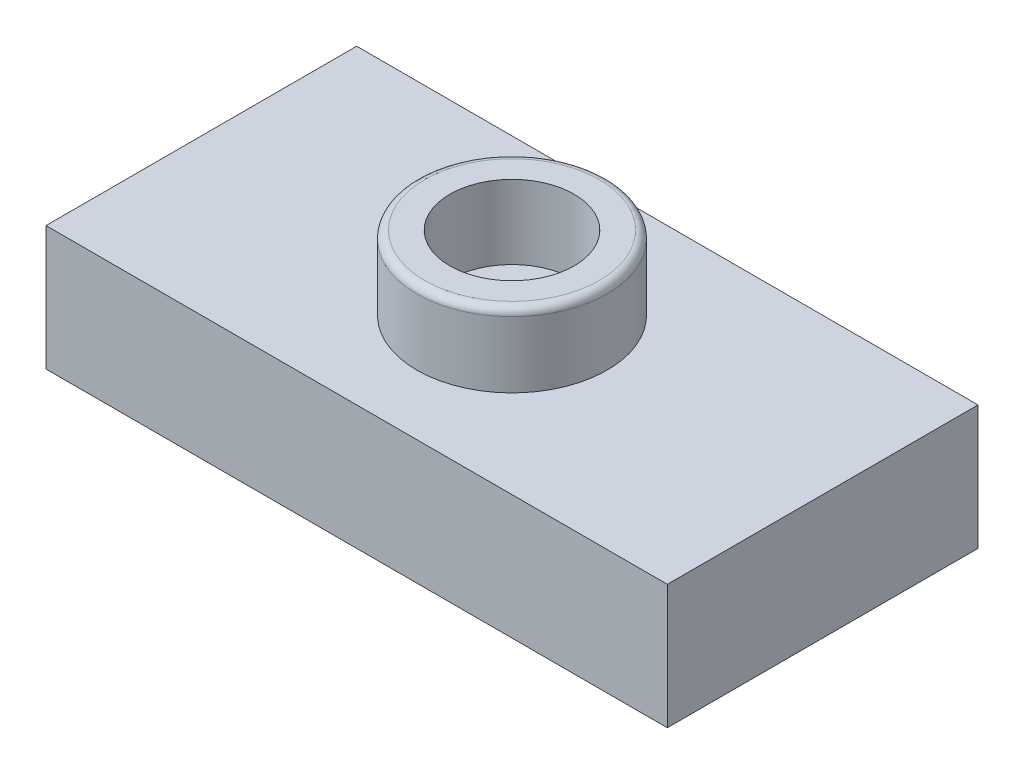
SolidWorks part; units mm, degrees
ref_plane "Vorne" through (0, 0, 0) normal (0, 0, 1) x (1, 0, 0)
ref_plane "Oben" through (0, 0, 0) normal (0, 1, 0) x (1, 0, 0)
ref_plane "Rechts" through (0, 0, 0) normal (1, 0, 0) x (0, 0, -1)
sketch "Skizze1" plane through (0, 0, 0) normal (0, 1, 0) x (1, 0, 0)
  line L1 (0, 0) -> (16, 0)
  line L2 (0, 0) -> (0, 8)
  line L3 (0, 8) -> (16, 8)
  line L4 (16, 0) -> (16, 8)
  dimension "D1" = 16
  dimension "D2" = 8
extrude "Linear austragen1" add sketch "Skizze1" along normal blind 3.2
sketch "Skizze2" plane through (0, 0, 0) normal (0, -1, 0) x (1, 0, 0)
  line L0 (0, 0) -> (16, 0) construction
  line L1 (1.6, -1.6) -> (14.4, -1.6)
  line L2 (1.6, -1.6) -> (1.6, -6.4)
  line L3 (1.6, -6.4) -> (14.4, -6.4)
  line L4 (14.4, -1.6) -> (14.4, -6.4)
  line L5 (16, -8) -> (0, -8) construction
  line L6 (16, 0) -> (16, -8) construction
  line L7 (0, -8) -> (0, 0) construction
  dimension "D1" = 1.6
  dimension "D2" = 1.6
  dimension "D3" = 1.6
  dimension "D4" = 1.6
extrude "Schnitt-Linear austragen1" cut sketch "Skizze2" against normal blind 2.1
sketch "Skizze3" plane through (0, 2.1, 0) normal (0, -1, 0) x (1, 0, 0)
  line L0 (16, 0) -> (16, -8) construction
  line L1 (16, -8) -> (0, -8) construction
  circle A0 centre (8, -4) radius 1.6
  dimension "D1" = 3.2
  dimension "D2" = 8
  dimension "D3" = 4
extrude "Linear austragen2" add sketch "Skizze3" along normal blind 1.9
fillet "Verrundung1" radius 0.2 1 edges at (8, 0.2, -5.6)
ref_plane "Ebene1" through (14.4, 2.1, -6.4) normal (1, 0, 0) x (0, 0, -1)
sketch "Skizze5" plane through (0, 3.2, 0) normal (0, 1, 0) x (-1, 0, 0)
  circle A0 centre (-8, -4) radius 2.45
  dimension "D1" = 4.9
extrude "Linear austragen3" add sketch "Skizze5" along normal blind 1.9
fillet "Verrundung2" radius 0.2 1 edges at (8, 5.1, -1.55)
sketch "Skizze6" plane through (0, 5.1, 0) normal (0, 1, 0) x (-1, 0, 0)
  circle A0 centre (-8, -4) radius 1.6
extrude "Schnitt-Linear austragen2" cut sketch "Skizze6" against normal blind 1.9
